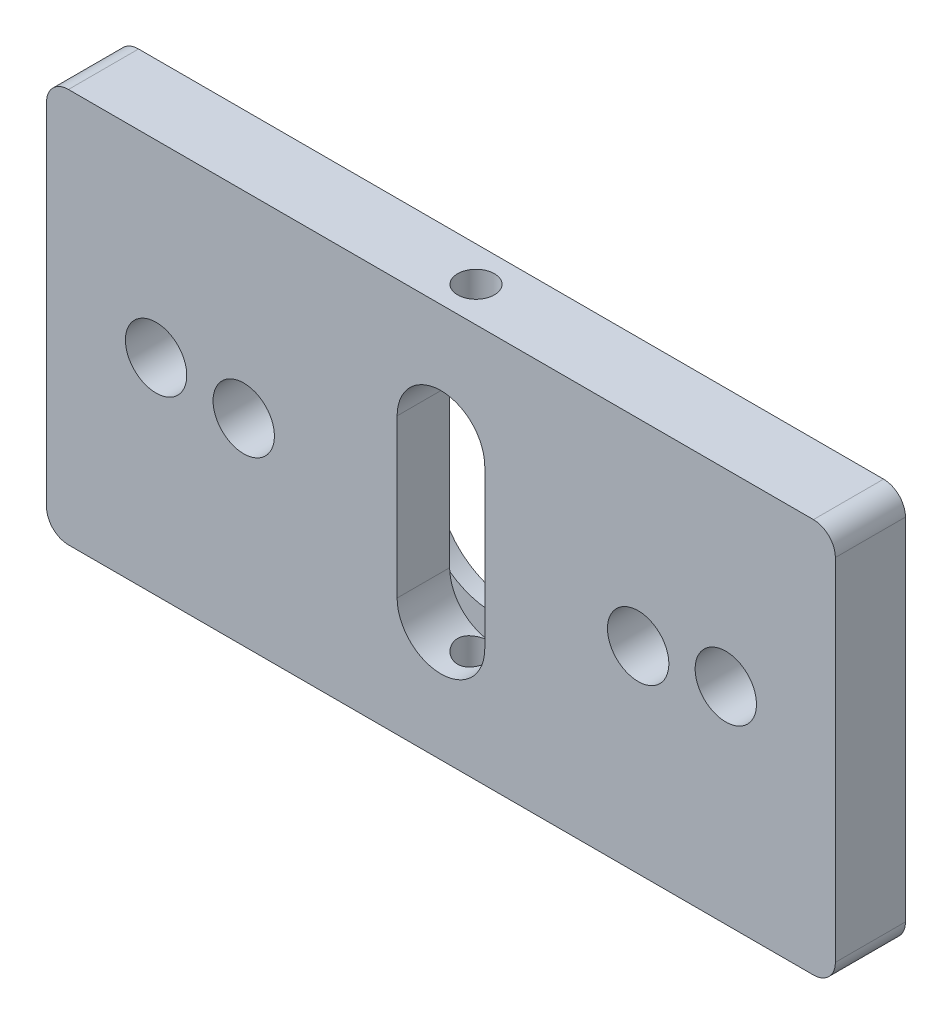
SolidWorks part; units mm, degrees
ref_plane "Front Plane" through (0, 0, 0) normal (0, 0, 1) x (1, 0, 0)
ref_plane "Top Plane" through (0, 0, 0) normal (0, 1, 0) x (1, 0, 0)
ref_plane "Right Plane" through (0, 0, 0) normal (1, 0, 0) x (0, 0, -1)
imported_body "Imported1"
hole_wizard "M8x1.0 Tapped Hole1" positions "3DSketch1" profile "Sketch1" tap size "M8x1.0" standard "Ansi Metric"
sketch3d "3DSketch1"
  line L0 (-32.5, 1, 8) -> (-32.5, 1, 0) construction
  line L1 (-22.5, 0, 8) -> (-22.5, 0, 0) construction
  line L2 (22.5, 0, 8) -> (22.5, 0, 0) construction
  line L3 (32.5, 1, 8) -> (32.5, 1, 0) construction
  point P0 (-32.5, 1, 0)
  point P4 (-22.5, 0, 0)
  point P8 (22.5, 0, 0)
  point P12 (32.5, 1, 0)
sketch "Sketch1" plane through (-32.5, 1, 0) normal (1, 0, 0) x (0, 1, 0)
  line L0 (0, 0) -> (0, 8)
  line L1 (0, 8) -> (3.5, 8)
  line L2 (3.5, 8) -> (3.5, 0)
  line L5 (3.5, 0) -> (0, 0)
  line L11 (0, -6.35) -> (0, 107.95) construction
  dimension "Thru Tap Drill Dia." = 7
  dimension "Thru Tap Drill Depth" = 8
hole_wizard "M5x0.8 Tapped Hole2" positions "3DSketch4" profile "Sketch4" tap size "M5x0.8" standard "Ansi Metric"
sketch3d "3DSketch4"
  line L0 (0, 13.9727, 4) -> (0, 22.5, 4) construction
  line L1 (0, -22.5, 4) -> (0, -10.984, 4) construction
  point P0 (0, 22.5, 4)
  point P4 (0, -22.5, 4)
sketch "Sketch4" plane through (0, 22.5, 4) normal (1, 0, 0) x (0, 0, 1)
  line L0 (0, 0) -> (0, 15.2618)
  line L1 (0, 15.2618) -> (2.1, 14)
  line L2 (2.1, 14) -> (2.1, 0)
  line L5 (2.1, 0) -> (0, 0)
  line L10 (0, 15.2618) -> (-2.1, 14) construction
  line L11 (0, -6.35) -> (0, 107.95) construction
  dimension "Tap Drill Dia." = 4.2
  dimension "Tap Drill Depth" = 14
  dimension "Drill Angle" = 118
